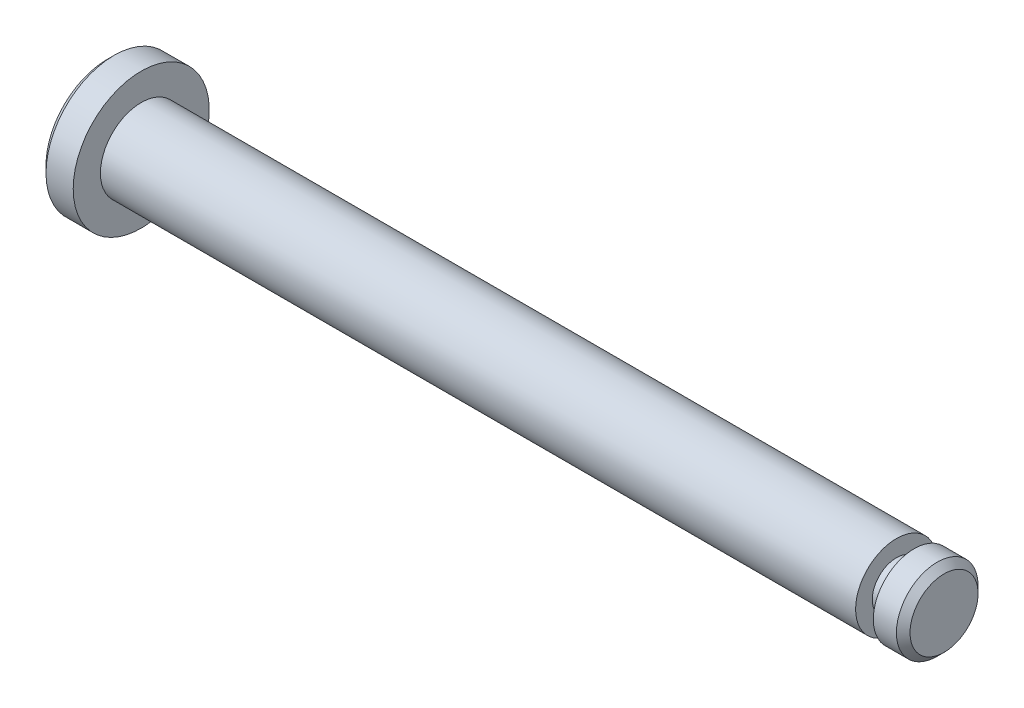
SolidWorks part; units mm, degrees
ref_plane "Plan de face" through (0, 0, 0) normal (0, 0, 1) x (1, 0, 0)
ref_plane "Plan de dessus" through (0, 0, 0) normal (0, 1, 0) x (1, 0, 0)
ref_plane "Plan de droite" through (0, 0, 0) normal (1, 0, 0) x (0, 0, -1)
sketch "Esquisse1" plane through (0, 0, 0) normal (0, 0, 1) x (1, 0, 0)
  line L0 (-49.6368, 0) -> (65.3921, 0) construction
  line L1 (-35.7171, 0) -> (-35.7171, 10)
  line L2 (-35.7171, 10) -> (-30.7171, 10)
  line L3 (-30.7171, 10) -> (-30.7171, 6)
  line L4 (-30.7171, 6) -> (80.2829, 6)
  line L5 (80.2829, 6) -> (80.2829, 3.5526)
  line L6 (80.2829, 3.5526) -> (82.8833, 3.5526)
  line L7 (82.8833, 3.5526) -> (82.8833, 6)
  line L8 (82.8833, 6) -> (87.2829, 6)
  line L9 (87.2829, 6) -> (87.2829, 0)
  line L10 (-35.7171, 0) -> (87.2829, 0)
  dimension "D1" = 6
  dimension "D2" = 10
  dimension "D3" = 5
  dimension "D4" = 111
  dimension "D5" = 118
revolve "Révolution1" add sketch "Esquisse1" angle 360 about L0
chamfer "Chanfrein1" distance 1 angle 45 1 edges at (87.2829, 0, 6)
chamfer "Chanfrein2" distance 1 angle 45 1 edges at (-35.7171, 0, 10)
